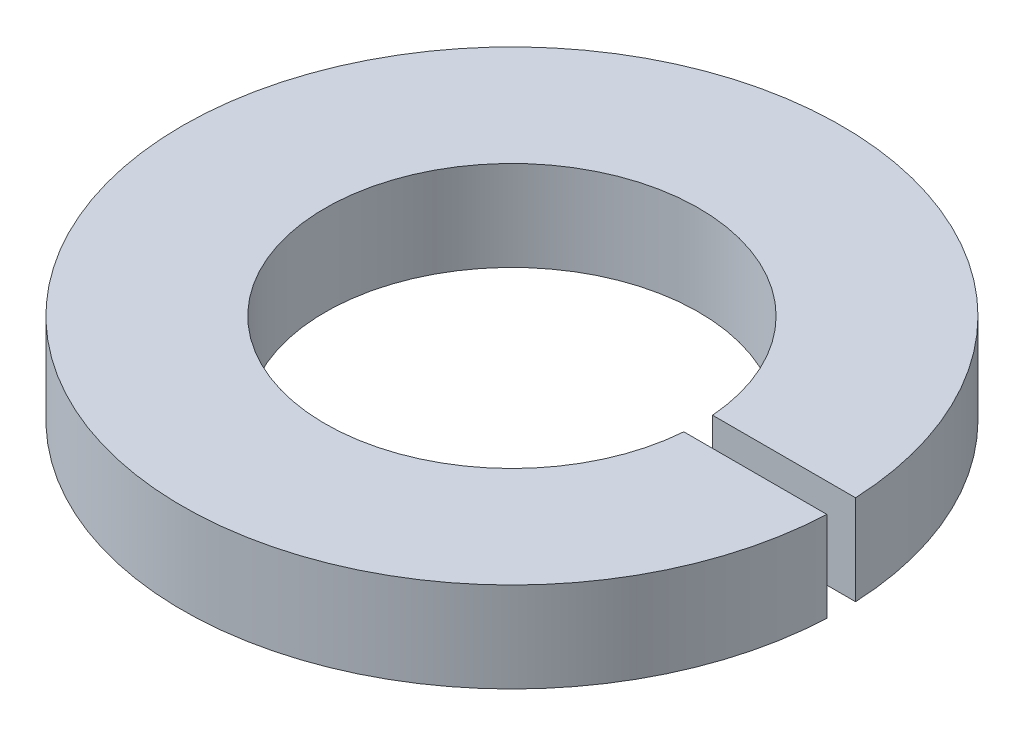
SolidWorks part; units mm, degrees
ref_plane "front" through (0, 0, 0) normal (0, 0, 1) x (1, 0, 0)
ref_plane "top" through (0, 0, 0) normal (0, 1, 0) x (1, 0, 0)
ref_plane "side" through (0, 0, 0) normal (1, 0, 0) x (0, 0, -1)
sketch "Sketch1" plane through (0, 0, 0) normal (0, 1, 0) x (1, 0, 0)
  circle A0 centre (0, 0) radius 4.953
  circle A1 centre (0, 0) radius 8.7376
  dimension "D1" = 17.4752
  dimension "D2" = 9.906
extrude "Base-Extrude" add sketch "Sketch1" along normal blind 2.3876
sketch "Sketch2" plane through (0, 2.3876, 0) normal (0, 1, 0) x (-1, 0, 0)
  line L0 (0, 0) -> (-14.5518, 0) construction
  line L1 (-8.7293, -0.381) -> (0, -0.381)
  line L2 (0, -0.381) -> (0, 0.381)
  line L3 (-8.7293, 0.381) -> (0, 0.381)
  circle A0 centre (0, 0) radius 8.7376 construction
  arc A1 (-8.7293, 0.381) -> (-8.7293, -0.381) centre (0, 0) ccw
  point P7 (-14.0898, 0)
  point P8 (0, 0)
  dimension "D1" = 0.762
extrude "Cut-Extrude1" cut sketch "Sketch2" against normal through all
